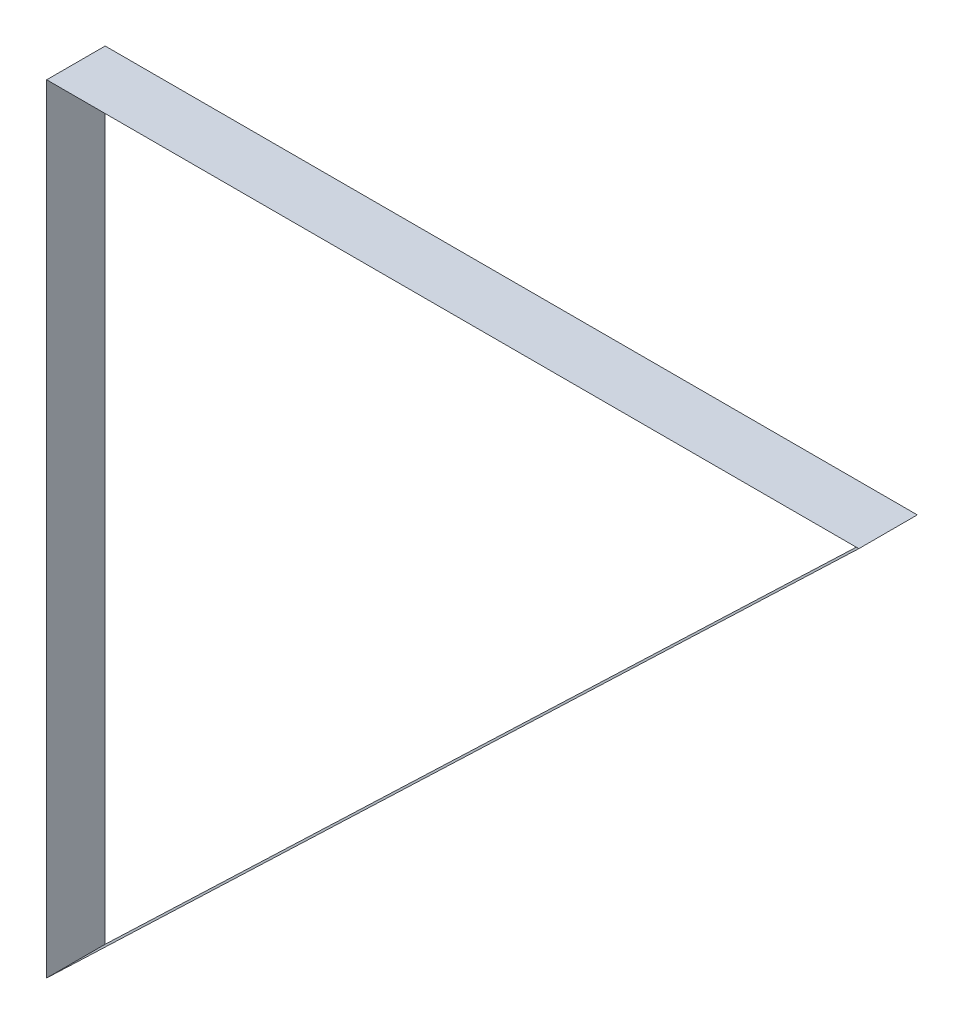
SolidWorks part; units mm, degrees
ref_plane "Ebene vorne" through (0, 0, 0) normal (0, 0, 1) x (1, 0, 0)
ref_plane "Ebene oben" through (0, 0, 0) normal (0, 1, 0) x (1, 0, 0)
ref_plane "Ebene rechts" through (0, 0, 0) normal (1, 0, 0) x (0, 0, -1)
sketch "Skizze1" plane through (0, 0, 0) normal (0, 0, 1) x (1, 0, 0)
  line L0 (0, 0) -> (0, 66.5039)
  line L1 (0, 66.5039) -> (69.4317, 66.5039)
  line L2 (69.4317, 66.5039) -> (0, 0)
  line L3 (34.7159, 33.2519) -> (0, 110.2821) construction
surface "Oberfläche-Linear austragen1" sketch "Skizze1" parameters "D1"=5
equation "\"LÄNGE\"=0"
equation "\"BREITE\"=0"
equation "\"HÖHE\"=0"
equation "\"DURCHMESSER\"=0"
equation "\"Stückzahl\"= 1"
